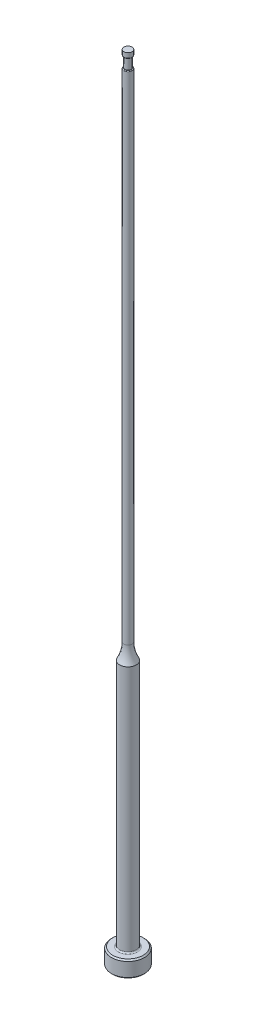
SolidWorks part; units mm, degrees
ref_plane "Front Plane" through (0, 0, 0) normal (0, 0, 1) x (1, 0, 0)
ref_plane "Top Plane" through (0, 0, 0) normal (0, 1, 0) x (1, 0, 0)
ref_plane "Right Plane" through (0, 0, 0) normal (1, 0, 0) x (0, 0, -1)
other "Configuration Table"
sketch "Sketch1" plane through (0, 0, 0) normal (0, 0, 1) x (1, 0, 0)
  line L0 (0, 259.9588) -> (0, -15.1925) construction
  line L1 (0, 0) -> (-3.175, 0)
  line L2 (-3.175, 0) -> (-3.175, 3.175)
  line L3 (-3.175, 3.175) -> (-1.5875, 3.175)
  line L4 (-0.7937, 53.8742) -> (-0.7937, 152.4)
  line L5 (-0.7937, 152.4) -> (0, 152.4)
  line L6 (0, 152.4) -> (0, 0)
  line L7 (-1.5875, 3.175) -> (-1.5875, 50.8)
  arc A1 (-1.5875, 50.8) -> (-0.7937, 53.8742) centre (-7.1437, 53.8742) ccw
  dimension "D1" = 6.35
  dimension "L" = 152.4
  dimension "D2" = 3.175
  dimension "H" = 6.35
  dimension "T" = 3.175
  dimension "D" = 1.5875
  dimension "S" = 50.8
revolve "Revolve1" add sketch "Sketch1" angle 360 about L0
chamfer "Chamfer1" distance 0.254 angle 45 2 edges at (0, 3.175, 3.175) (0, 0, 3.175)
fillet "Fillet1" radius 0.254 1 edges at (0, 3.175, 1.5875)
sketch "Sketch2" plane through (0, 0, 0) normal (0, 0, 1) x (1, 0, 0)
  line L0 (-0.7937, 152.4) -> (-0.7937, 53.8742) construction
  line L1 (-0.7937, 151.384) -> (-0.5905, 151.384)
  line L2 (-0.7937, 151.384) -> (-0.7937, 149.352)
  line L3 (-0.7937, 149.352) -> (-0.5905, 149.352)
  line L4 (-0.5905, 151.384) -> (-0.5905, 149.352)
  line L5 (0.7937, 152.4) -> (-0.7937, 152.4) construction
  line L6 (0, 153.4483) -> (0, 147.3282) construction
  dimension "D1" = 2.032
  dimension "N" = 1.016
  dimension "FD" = 0.2032
  dimension "D3" = 1.1811
revolve "Vent Relief" cut sketch "Sketch2" angle 360 about L6
sketch "Sketch3" plane through (0, 0, 0) normal (0, 0, 1) x (1, 0, 0)
  line L0 (-0.5905, 150.368) -> (-0.5905, 112.268)
  line L1 (-0.5905, 151.384) -> (-0.5905, 149.352) construction
  line L2 (-0.7937, 149.352) -> (-0.7937, 53.8742) construction
  line L3 (-0.7937, 111.1504) -> (-0.7937, 150.368)
  line L4 (-0.7937, 150.368) -> (-0.5905, 150.368)
  arc A0 (-0.5905, 112.268) -> (-0.7937, 111.1504) centre (-3.7655, 112.268) cw
  dimension "D1" = 3.175
  dimension "D2" = 38.1
extrude "D-Slot" cut sketch "Sketch3" against normal through all both and the other way through all
sketch "Sketch5" plane through (0, 0, 0) normal (0, 0, 1) x (1, 0, 0)
  line L0 (-0.7937, 151.384) -> (0.7937, 151.384) construction
  line L1 (-0.7937, 152.4) -> (-0.7887, 152.4)
  line L2 (-0.7937, 152.4) -> (-0.7937, 151.384)
  line L3 (-0.7937, 151.384) -> (-0.7887, 151.384)
  line L4 (-0.7887, 152.4) -> (-0.7887, 151.384)
  line L5 (0, 152.6877) -> (0, 150.5771) construction
  dimension "VP" = 0.0051
revolve "Vent Diameter" cut sketch "Sketch5" angle 360 about L5
fillet "Fillet2" radius 0.127 2 edges at (0.7937, 149.352, 0) (0, 151.384, 0.7887)
sketch "Pocket Sketch" plane through (0, 0, 0) normal (0, 0, 1) x (1, 0, 0)
  line L0 (-3.5719, 0) -> (-3.5719, 3.2004)
  line L1 (-3.5719, 3.2004) -> (-1.7542, 3.2004)
  line L2 (-0.9922, 3.9624) -> (-0.9922, 22.225)
  line L3 (-0.9922, 22.225) -> (0, 22.225)
  line L4 (0, 22.225) -> (0, 0)
  line L5 (0, 0) -> (-3.5719, 0)
  line L6 (0, 12.6104) -> (0, -2.4989) construction
  line L7 (-3.175, 2.921) -> (-3.175, 0.254) construction
  line L8 (2.921, 3.175) -> (-2.921, 3.175) construction
  line L9 (-0.7937, 111.1504) -> (-0.7937, 53.8742) construction
  line L10 (-1.7542, 3.2004) -> (-0.9922, 3.9624)
  point P3 (-0.9922, 3.2004)
  dimension "D1" = 7.1437
  dimension "D2" = 0.3969
  dimension "D3" = 0.0254
  dimension "D4" = 0.1984
  dimension "D5" = 1.9844
  dimension "D6" = 22.225
